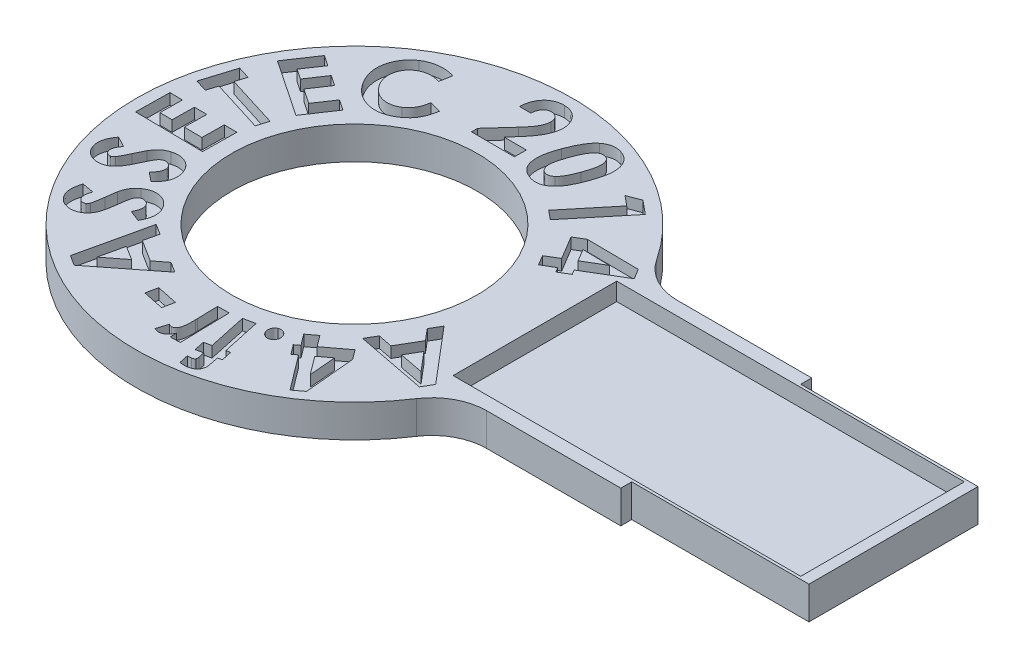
SolidWorks part; units mm, degrees
ref_plane "Plan de face" through (0, 0, 0) normal (0, 0, 1) x (1, 0, 0)
ref_plane "Plan de dessus" through (0, 0, 0) normal (0, 1, 0) x (1, 0, 0)
ref_plane "Plan de droite" through (0, 0, 0) normal (1, 0, 0) x (0, 0, -1)
sketch "Esquisse1" plane through (0, 0, 0) normal (0, 1, 0) x (1, 0, 0)
  line L0 (-65.3221, 0) -> (85.4006, 0) construction
  line L1 (0, 35.8736) -> (0, -40.6924) construction
  line L2 (-1.5, 11.7069) -> (-1.5, -9.2007) construction
  line L3 (-25, 6.2) -> (25, 6.2) construction
  line L4 (-25, 6.2) -> (-25, -6.2) construction
  line L5 (-25, -6.2) -> (25, -6.2) construction
  line L6 (25, 6.2) -> (25, -6.2)
  line L7 (-25, 6.2) -> (25, -6.2) construction
  line L8 (-25, -6.2) -> (25, 6.2) construction
  line L9 (12, 6.2) -> (12, 7)
  line L10 (12, -6.2) -> (25, -6.2)
  line L11 (12, 6.2) -> (25, 6.2)
  line L12 (-0.1506, -7) -> (12, -7)
  line L14 (-0.1506, 7) -> (12, 7)
  line L15 (12, -7) -> (12, -6.2)
  line L16 (-19.5995, -7) -> (12, 7) construction
  line L17 (-19.5995, 7) -> (12, -7) construction
  arc A0 (-3.5385, 7) -> (-3.5385, -7) centre (-14.5381, 0) ccw construction
  arc A1 (-0.1506, 7) -> (-0.1506, -7) centre (-14.5381, 0) ccw
  point P5 (0, 0)
  point P14 (-3.7998, 0)
  dimension "D4" = 13
  dimension "D1" = 12.4
  dimension "D2" = 50
  dimension "D3" = 1.5
  dimension "D5" = 14
extrude "Boss.-Extru.1" add sketch "Esquisse1" against normal blind 2.4
sketch "Esquisse2" plane through (0, 0, 0) normal (0, 1, 0) x (1, 0, 0)
  line L1 (-1.3, 6) -> (24.2, 6)
  line L2 (-1.3, 6) -> (-1.3, -6)
  line L3 (-1.3, -6) -> (24.2, -6)
  line L4 (24.2, 6) -> (24.2, -6)
  line L6 (25, -6.2) -> (25, 6.2) construction
  line L7 (0, 0) -> (0, 9.6803) construction
  line L8 (-2.3, 10.2545) -> (-2.3, -8.4238) construction
  line L9 (12, -6.2) -> (25, -6.2) construction
  line L10 (25, 6.2) -> (-3.0685, 6.2) construction
  dimension "D1" = 12
  dimension "D2" = 0.2
  dimension "D3" = 0.2
  dimension "D4" = 0.8
  dimension "D5" = 25.5
  dimension "D6" = 1
  dimension "D7" = 2.3
extrude "Enlèv. mat.-Extru.1" cut sketch "Esquisse2" against normal blind 1.3
sketch "Esquisse3" plane through (0, 0, 0) normal (0, 1, 0) x (1, 0, 0)
  circle A0 centre (-14.5381, 0) radius 9
extrude "Enlèv. mat.-Extru.2" cut sketch "Esquisse3" against normal through all
sketch "Esquisse4" plane through (0, 0, 0) normal (0, 1, 0) x (1, 0, 0)
  line L0 (-14.5381, 0) -> (-3.3986, 4.2924) construction
  line L1 (-14.5381, 0) -> (-3.8564, -0.7927) construction
  arc A0 (-4.9269, 3.7035) -> (-4.2663, -0.7623) centre (-14.5381, 0) ccw construction
  text T0 "A4.fr-ASSETEC 2014" font "Century Gothic" height 5
extrude "Enlèv. mat.-Extru.3" cut sketch "Esquisse4" against normal blind 0.8
fillet "Congé1" radius 4 2 edges at (-0.1506, -1.2, 7) (-0.1506, -1.2, -7)
